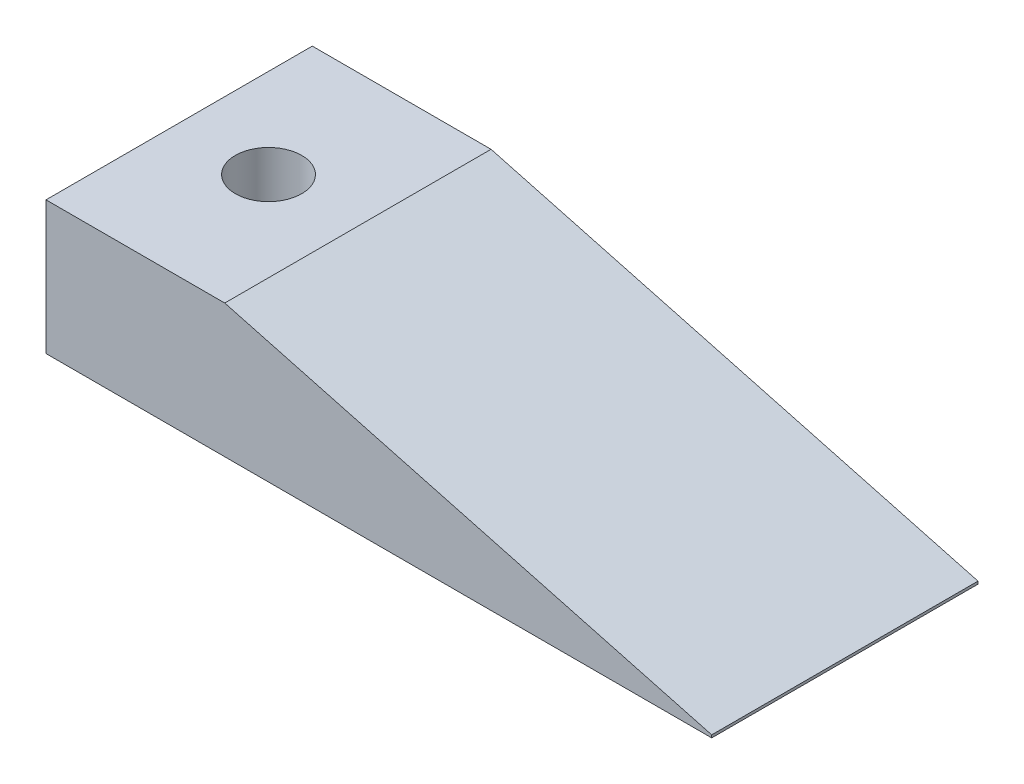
SolidWorks part; units mm, degrees
ref_plane "Vorne" through (0, 0, 0) normal (0, 0, 1) x (1, 0, 0)
ref_plane "Oben" through (0, 0, 0) normal (0, 1, 0) x (1, 0, 0)
ref_plane "Rechts" through (0, 0, 0) normal (1, 0, 0) x (0, 0, -1)
sketch "Skizze1" plane through (0, 0, 0) normal (0, 1, 0) x (1, 0, 0)
  line L1 (0, 10) -> (50, 10)
  line L2 (0, 10) -> (0, -10)
  line L3 (0, -10) -> (50, -10)
  line L4 (50, 10) -> (50, -10)
  point P4 (50, 0)
  point P5 (25, 10)
  dimension "D1" = 20
  dimension "D2" = 50
extrude "Linear austragen1" add sketch "Skizze1" along normal blind 10
sketch "Skizze2" plane through (0, 0, 10) normal (0, 0, 1) x (1, 0, 0)
  line L0 (13.4259, 10) -> (50, 0.2)
  line L1 (0, 10) -> (50, 10) construction
  line L2 (50, 10) -> (50, 0) construction
  line L3 (0, 0) -> (50, 0) construction
  dimension "D1" = 15
  dimension "D2" = 0.2
extrude "Schnitt-Linear austragen1" cut sketch "Skizze2" against normal through all and the other way through all
sketch "Skizze3" plane through (0, 10, 0) normal (0, 1, 0) x (1, 0, 0)
  line L0 (0, 10) -> (0, -10) construction
  line L1 (0, -10) -> (13.4259, -10) construction
  circle A0 centre (6.713, 0) radius 2.4939
  point P4 (0, 0)
  point P7 (6.713, -10)
extrude "Schnitt-Linear austragen2" cut sketch "Skizze3" against normal through all
